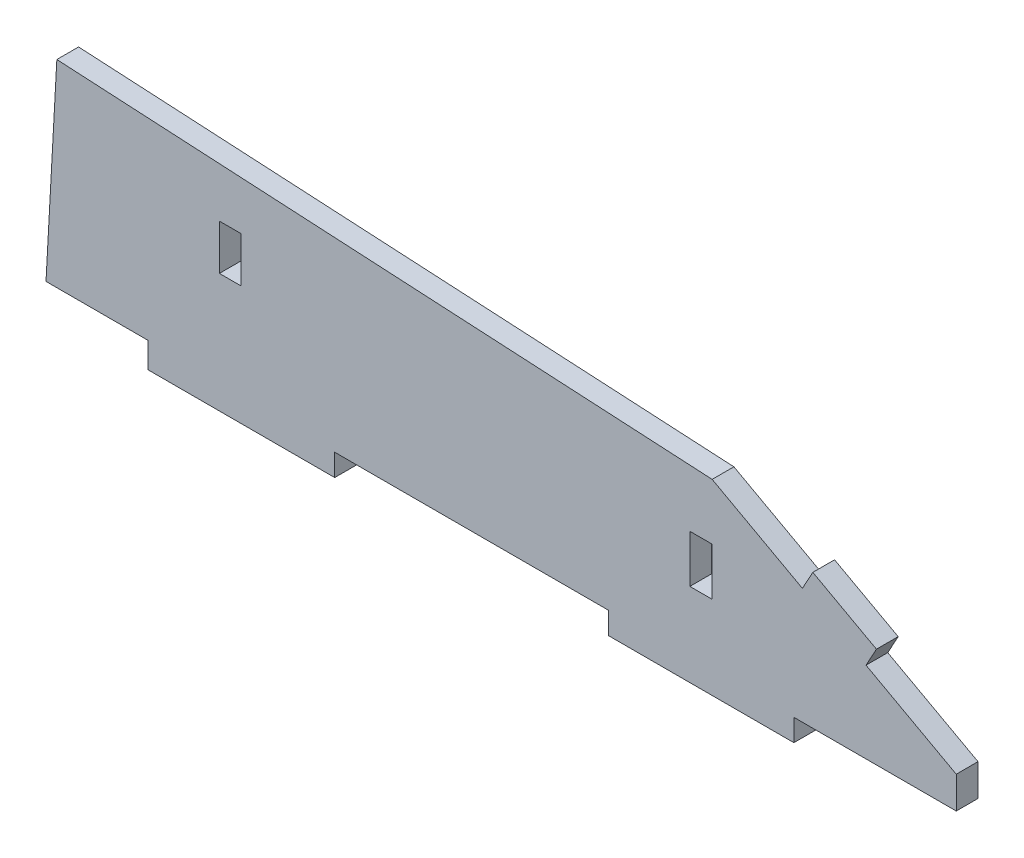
SolidWorks part; units mm, degrees
ref_plane "Front Plane" through (0, 0, 0) normal (0, 0, 1) x (1, 0, 0)
ref_plane "Top Plane" through (0, 0, 0) normal (0, 1, 0) x (1, 0, 0)
ref_plane "Right Plane" through (0, 0, 0) normal (1, 0, 0) x (0, 0, -1)
sketch "Sketch1" plane through (0, 0, 0) normal (0, 0, 1) x (1, 0, 0)
  line L0 (-1.524, -7.3636) -> (-13.6776, -7.3636)
  line L1 (-13.6776, -7.3636) -> (-12.9177, 6.4888)
  line L2 (-6.5267, -7.3636) -> (-6.5267, -9.151)
  line L3 (-6.5267, -9.151) -> (6.5578, -9.151)
  line L4 (6.5578, -9.151) -> (6.5578, -7.6104)
  line L5 (6.5578, -7.6104) -> (25.7442, -7.6104)
  line L6 (25.7442, -7.6104) -> (25.7442, -9.151)
  line L7 (25.7442, -9.151) -> (38.7423, -9.151)
  line L8 (38.7423, -9.151) -> (38.7423, -7.6104)
  line L9 (38.7423, -7.6104) -> (50.1231, -7.6104)
  line L10 (50.1231, -7.6104) -> (50.1231, -5.3731)
  line L11 (50.1231, -5.3731) -> (43.7978, -1.9193)
  line L12 (33.0139, 3.969) -> (-12.9177, 6.4888)
  line L13 (0, 2.376) -> (0, 5.5848) construction
  line L14 (0, 2.376) -> (-1.524, 2.376)
  line L15 (0, 2.376) -> (0, -0.7991)
  line L16 (0, -0.7991) -> (-1.524, -0.7991)
  line L17 (-1.524, 2.376) -> (-1.524, -0.7991)
  line L18 (-1.524, 2.376) -> (0, 2.376) construction
  line L19 (39.3392, 0.5152) -> (33.0139, 3.969)
  line L20 (33.0139, 0.0357) -> (31.4497, 0.0357)
  line L21 (33.0139, 0.0357) -> (33.0139, -3.3106)
  line L22 (33.0139, -3.3106) -> (31.4497, -3.3106)
  line L23 (31.4497, 0.0357) -> (31.4497, -3.3106)
  line L24 (43.7978, -1.9193) -> (44.5282, -0.5817)
  line L25 (39.3392, 0.5152) -> (40.0695, 1.8528)
  line L27 (44.5282, -0.5817) -> (40.0695, 1.8528)
extrude "Boss-Extrude1" add sketch "Sketch1" along normal blind 1.524
